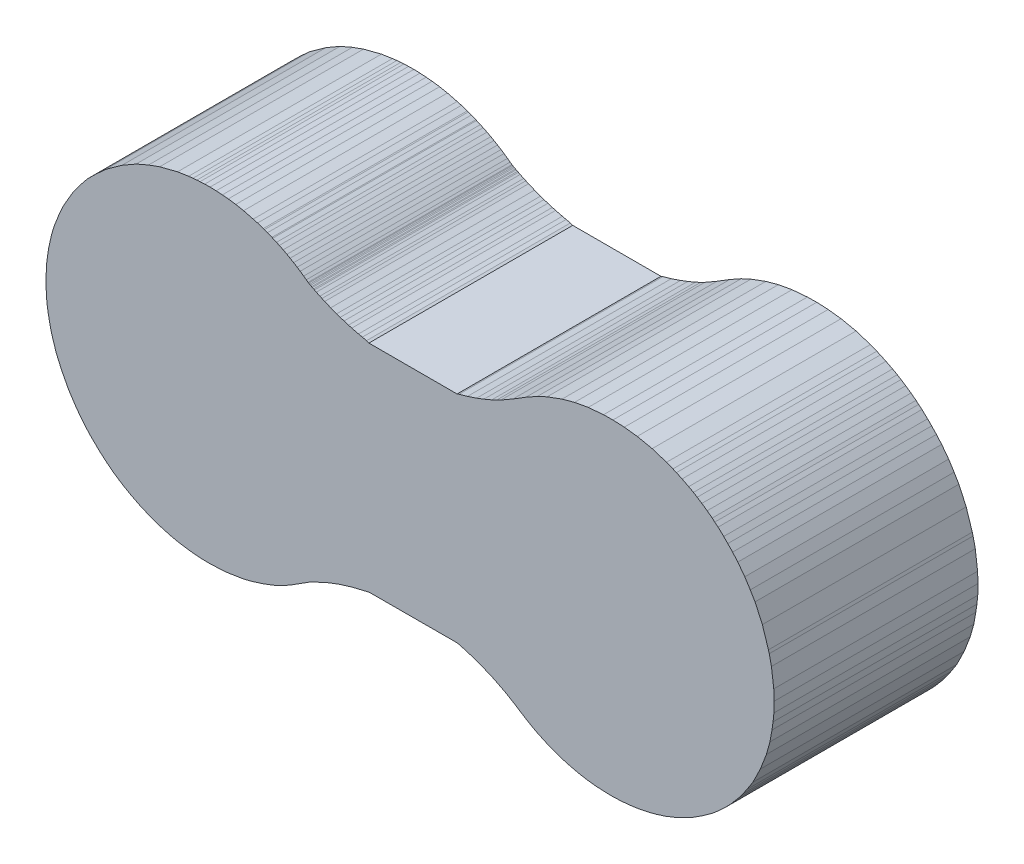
SolidWorks part; units mm, degrees
ref_plane "Front Plane" through (0, 0, 0) normal (0, 0, 1) x (1, 0, 0)
ref_plane "Top Plane" through (0, 0, 0) normal (0, 1, 0) x (1, 0, 0)
ref_plane "Right Plane" through (0, 0, 0) normal (1, 0, 0) x (0, 0, -1)
sketch "GENERAL" plane through (0, 0, 0) normal (0, 0, 1) x (1, 0, 0)
  line L0 (0.1181, 0.2672) -> (-0.1017, 0.2672)
  line L1 (-0.1017, 0.2672) -> (-0.1075, 0.2695)
  line L2 (-0.1075, 0.2695) -> (-0.1181, 0.2718)
  line L3 (-0.1181, 0.2718) -> (-0.1276, 0.2739)
  line L4 (-0.1276, 0.2739) -> (-0.1443, 0.2781)
  line L5 (-0.1443, 0.2781) -> (-0.1526, 0.2804)
  line L6 (-0.1526, 0.2804) -> (-0.1636, 0.2839)
  line L7 (-0.1636, 0.2839) -> (-0.1733, 0.2869)
  line L8 (-0.1733, 0.2869) -> (-0.1821, 0.2901)
  line L9 (-0.1821, 0.2901) -> (-0.1968, 0.2957)
  line L10 (-0.1968, 0.2957) -> (-0.212, 0.3018)
  line L11 (-0.212, 0.3018) -> (-0.2186, 0.3049)
  line L12 (-0.2186, 0.3049) -> (-0.2239, 0.3073)
  line L13 (-0.2239, 0.3073) -> (-0.2327, 0.3115)
  line L14 (-0.2327, 0.3115) -> (-0.2357, 0.3131)
  line L15 (-0.2357, 0.3131) -> (-0.2374, 0.3139)
  line L16 (-0.2374, 0.3139) -> (-0.2395, 0.315)
  line L17 (-0.2395, 0.315) -> (-0.2426, 0.3166)
  line L18 (-0.2426, 0.3166) -> (-0.2444, 0.3176)
  line L19 (-0.2444, 0.3176) -> (-0.2473, 0.3191)
  line L20 (-0.2473, 0.3191) -> (-0.2495, 0.3203)
  line L21 (-0.2495, 0.3203) -> (-0.2516, 0.3215)
  line L22 (-0.2516, 0.3215) -> (-0.2528, 0.3221)
  line L23 (-0.2528, 0.3221) -> (-0.2533, 0.3224)
  line L24 (-0.2533, 0.3224) -> (-0.2577, 0.3258)
  line L25 (-0.2577, 0.3258) -> (-0.2643, 0.3305)
  line L26 (-0.2643, 0.3305) -> (-0.273, 0.3365)
  line L27 (-0.273, 0.3365) -> (-0.2804, 0.3415)
  line L28 (-0.2804, 0.3415) -> (-0.2892, 0.3469)
  line L29 (-0.2892, 0.3469) -> (-0.2981, 0.3522)
  line L30 (-0.2981, 0.3522) -> (-0.306, 0.3566)
  line L31 (-0.306, 0.3566) -> (-0.3155, 0.3616)
  line L32 (-0.3155, 0.3616) -> (-0.3251, 0.3663)
  line L33 (-0.3251, 0.3663) -> (-0.332, 0.3694)
  line L34 (-0.332, 0.3694) -> (-0.3414, 0.3736)
  line L35 (-0.3414, 0.3736) -> (-0.3434, 0.3744)
  line L36 (-0.3434, 0.3744) -> (-0.3546, 0.3789)
  line L37 (-0.3546, 0.3789) -> (-0.3622, 0.3817)
  line L38 (-0.3622, 0.3817) -> (-0.3649, 0.3827)
  line L39 (-0.3649, 0.3827) -> (-0.3792, 0.3875)
  line L40 (-0.3792, 0.3875) -> (-0.3899, 0.3906)
  line L41 (-0.3899, 0.3906) -> (-0.4141, 0.3967)
  line L42 (-0.4141, 0.3967) -> (-0.4335, 0.4005)
  line L43 (-0.4335, 0.4005) -> (-0.4522, 0.403)
  line L44 (-0.4522, 0.403) -> (-0.4669, 0.4044)
  line L45 (-0.4669, 0.4044) -> (-0.4823, 0.4055)
  line L46 (-0.4823, 0.4055) -> (-0.4976, 0.4059)
  line L47 (-0.4976, 0.4059) -> (-0.5109, 0.4057)
  line L48 (-0.5109, 0.4057) -> (-0.5225, 0.4051)
  line L49 (-0.5225, 0.4051) -> (-0.5303, 0.4047)
  line L50 (-0.5303, 0.4047) -> (-0.54, 0.4038)
  line L51 (-0.54, 0.4038) -> (-0.551, 0.4026)
  line L52 (-0.551, 0.4026) -> (-0.5785, 0.3984)
  line L53 (-0.5785, 0.3984) -> (-0.6231, 0.3869)
  line L54 (-0.6231, 0.3869) -> (-0.6508, 0.377)
  line L55 (-0.6508, 0.377) -> (-0.6819, 0.3635)
  line L56 (-0.6819, 0.3635) -> (-0.7168, 0.3433)
  line L57 (-0.7168, 0.3433) -> (-0.7576, 0.314)
  line L58 (-0.7576, 0.314) -> (-0.7821, 0.2915)
  line L59 (-0.7821, 0.2915) -> (-0.8028, 0.2712)
  line L60 (-0.8028, 0.2712) -> (-0.8242, 0.2447)
  line L61 (-0.8242, 0.2447) -> (-0.8394, 0.2233)
  line L62 (-0.8394, 0.2233) -> (-0.8614, 0.1859)
  line L63 (-0.8614, 0.1859) -> (-0.8724, 0.1623)
  line L64 (-0.8724, 0.1623) -> (-0.8811, 0.1402)
  line L65 (-0.8811, 0.1402) -> (-0.8849, 0.1303)
  line L66 (-0.8849, 0.1303) -> (-0.8921, 0.1077)
  line L67 (-0.8921, 0.1077) -> (-0.9001, 0.0717)
  line L68 (-0.9001, 0.0717) -> (-0.9045, 0.0409)
  line L69 (-0.9045, 0.0409) -> (-0.9064, 0.0062)
  line L70 (-0.9064, 0.0062) -> (-0.9064, -0.0114)
  line L71 (-0.9064, -0.0114) -> (-0.9042, -0.0468)
  line L72 (-0.9042, -0.0468) -> (-0.9009, -0.0683)
  line L73 (-0.9009, -0.0683) -> (-0.8943, -0.1005)
  line L74 (-0.8943, -0.1005) -> (-0.8877, -0.1227)
  line L75 (-0.8877, -0.1227) -> (-0.8805, -0.1445)
  line L76 (-0.8805, -0.1445) -> (-0.8682, -0.1728)
  line L77 (-0.8682, -0.1728) -> (-0.8506, -0.2066)
  line L78 (-0.8506, -0.2066) -> (-0.831, -0.2363)
  line L79 (-0.831, -0.2363) -> (-0.8178, -0.2545)
  line L80 (-0.8178, -0.2545) -> (-0.8044, -0.2702)
  line L81 (-0.8044, -0.2702) -> (-0.7942, -0.281)
  line L82 (-0.7942, -0.281) -> (-0.7737, -0.3011)
  line L83 (-0.7737, -0.3011) -> (-0.7545, -0.3177)
  line L84 (-0.7545, -0.3177) -> (-0.7374, -0.3308)
  line L85 (-0.7374, -0.3308) -> (-0.7239, -0.34)
  line L86 (-0.7239, -0.34) -> (-0.7137, -0.3464)
  line L87 (-0.7137, -0.3464) -> (-0.6962, -0.3566)
  line L88 (-0.6962, -0.3566) -> (-0.6705, -0.3697)
  line L89 (-0.6705, -0.3697) -> (-0.65, -0.3781)
  line L90 (-0.65, -0.3781) -> (-0.6283, -0.3864)
  line L91 (-0.6283, -0.3864) -> (-0.5995, -0.3947)
  line L92 (-0.5995, -0.3947) -> (-0.5757, -0.4001)
  line L93 (-0.5757, -0.4001) -> (-0.5478, -0.4042)
  line L94 (-0.5478, -0.4042) -> (-0.5235, -0.4065)
  line L95 (-0.5235, -0.4065) -> (-0.502, -0.4071)
  line L96 (-0.502, -0.4071) -> (-0.4639, -0.4057)
  line L97 (-0.4639, -0.4057) -> (-0.4478, -0.4036)
  line L98 (-0.4478, -0.4036) -> (-0.4134, -0.398)
  line L99 (-0.4134, -0.398) -> (-0.3919, -0.3926)
  line L100 (-0.3919, -0.3926) -> (-0.3635, -0.3835)
  line L101 (-0.3635, -0.3835) -> (-0.341, -0.375)
  line L102 (-0.341, -0.375) -> (-0.3232, -0.367)
  line L103 (-0.3232, -0.367) -> (-0.2985, -0.3537)
  line L104 (-0.2985, -0.3537) -> (-0.2604, -0.3295)
  line L105 (-0.2604, -0.3295) -> (-0.2491, -0.3224)
  line L106 (-0.2491, -0.3224) -> (-0.2342, -0.3151)
  line L107 (-0.2342, -0.3151) -> (-0.2079, -0.3028)
  line L108 (-0.2079, -0.3028) -> (-0.1868, -0.2945)
  line L109 (-0.1868, -0.2945) -> (-0.1741, -0.2899)
  line L110 (-0.1741, -0.2899) -> (-0.1451, -0.281)
  line L111 (-0.1451, -0.281) -> (-0.1265, -0.2764)
  line L112 (-0.1265, -0.2764) -> (-0.1102, -0.2726)
  line L113 (-0.1102, -0.2726) -> (-0.1013, -0.2702)
  line L114 (-0.1013, -0.2702) -> (-0.0886, -0.2702)
  line L115 (-0.0886, -0.2702) -> (0.1186, -0.2699)
  line L116 (0.1186, -0.2699) -> (0.1268, -0.2719)
  line L117 (0.1268, -0.2719) -> (0.1438, -0.2769)
  line L118 (0.1438, -0.2769) -> (0.1632, -0.2833)
  line L119 (0.1632, -0.2833) -> (0.18, -0.2895)
  line L120 (0.18, -0.2895) -> (0.2059, -0.3002)
  line L121 (0.2059, -0.3002) -> (0.2223, -0.3083)
  line L122 (0.2223, -0.3083) -> (0.2382, -0.3165)
  line L123 (0.2382, -0.3165) -> (0.2608, -0.3299)
  line L124 (0.2608, -0.3299) -> (0.2739, -0.3382)
  line L125 (0.2739, -0.3382) -> (0.2765, -0.3401)
  line L126 (0.2765, -0.3401) -> (0.2933, -0.3504)
  line L127 (0.2933, -0.3504) -> (0.3076, -0.3587)
  line L128 (0.3076, -0.3587) -> (0.3201, -0.3653)
  line L129 (0.3201, -0.3653) -> (0.3414, -0.375)
  line L130 (0.3414, -0.375) -> (0.3593, -0.3823)
  line L131 (0.3593, -0.3823) -> (0.3827, -0.3901)
  line L132 (0.3827, -0.3901) -> (0.3997, -0.3949)
  line L133 (0.3997, -0.3949) -> (0.4221, -0.4001)
  line L134 (0.4221, -0.4001) -> (0.4429, -0.4037)
  line L135 (0.4429, -0.4037) -> (0.4627, -0.4059)
  line L136 (0.4627, -0.4059) -> (0.4817, -0.4072)
  line L137 (0.4817, -0.4072) -> (0.5052, -0.4078)
  line L138 (0.5052, -0.4078) -> (0.5276, -0.4069)
  line L139 (0.5276, -0.4069) -> (0.5542, -0.4043)
  line L140 (0.5542, -0.4043) -> (0.5738, -0.4013)
  line L141 (0.5738, -0.4013) -> (0.5937, -0.3971)
  line L142 (0.5937, -0.3971) -> (0.6127, -0.3922)
  line L143 (0.6127, -0.3922) -> (0.6358, -0.3851)
  line L144 (0.6358, -0.3851) -> (0.6623, -0.3746)
  line L145 (0.6623, -0.3746) -> (0.682, -0.3652)
  line L146 (0.682, -0.3652) -> (0.7064, -0.3523)
  line L147 (0.7064, -0.3523) -> (0.7319, -0.3358)
  line L148 (0.7319, -0.3358) -> (0.7543, -0.3196)
  line L149 (0.7543, -0.3196) -> (0.7677, -0.3082)
  line L150 (0.7677, -0.3082) -> (0.7855, -0.2918)
  line L151 (0.7855, -0.2918) -> (0.7992, -0.2778)
  line L152 (0.7992, -0.2778) -> (0.8201, -0.2533)
  line L153 (0.8201, -0.2533) -> (0.8304, -0.2395)
  line L154 (0.8304, -0.2395) -> (0.8404, -0.2251)
  line L155 (0.8404, -0.2251) -> (0.8553, -0.202)
  line L156 (0.8553, -0.202) -> (0.8738, -0.1644)
  line L157 (0.8738, -0.1644) -> (0.8889, -0.1253)
  line L158 (0.8889, -0.1253) -> (0.8978, -0.0938)
  line L159 (0.8978, -0.0938) -> (0.9028, -0.0657)
  line L160 (0.9028, -0.0657) -> (0.9055, -0.0468)
  line L161 (0.9055, -0.0468) -> (0.9076, -0.0264)
  line L162 (0.9076, -0.0264) -> (0.9083, -0.0008)
  line L163 (0.9083, -0.0008) -> (0.9072, 0.0253)
  line L164 (0.9072, 0.0253) -> (0.9015, 0.0709)
  line L165 (0.9015, 0.0709) -> (0.8961, 0.0957)
  line L166 (0.8961, 0.0957) -> (0.894, 0.103)
  line L167 (0.894, 0.103) -> (0.8789, 0.1499)
  line L168 (0.8789, 0.1499) -> (0.8607, 0.1898)
  line L169 (0.8607, 0.1898) -> (0.8487, 0.2098)
  line L170 (0.8487, 0.2098) -> (0.8351, 0.2312)
  line L171 (0.8351, 0.2312) -> (0.8177, 0.2542)
  line L172 (0.8177, 0.2542) -> (0.8046, 0.2692)
  line L173 (0.8046, 0.2692) -> (0.7927, 0.2816)
  line L174 (0.7927, 0.2816) -> (0.7826, 0.2919)
  line L175 (0.7826, 0.2919) -> (0.7685, 0.3051)
  line L176 (0.7685, 0.3051) -> (0.7603, 0.3118)
  line L177 (0.7603, 0.3118) -> (0.7538, 0.3173)
  line L178 (0.7538, 0.3173) -> (0.7412, 0.3268)
  line L179 (0.7412, 0.3268) -> (0.7281, 0.336)
  line L180 (0.7281, 0.336) -> (0.7165, 0.3435)
  line L181 (0.7165, 0.3435) -> (0.707, 0.3492)
  line L182 (0.707, 0.3492) -> (0.6953, 0.3559)
  line L183 (0.6953, 0.3559) -> (0.6788, 0.3642)
  line L184 (0.6788, 0.3642) -> (0.6648, 0.3708)
  line L185 (0.6648, 0.3708) -> (0.656, 0.3744)
  line L186 (0.656, 0.3744) -> (0.64, 0.3808)
  line L187 (0.64, 0.3808) -> (0.6043, 0.3924)
  line L188 (0.6043, 0.3924) -> (0.567, 0.4001)
  line L189 (0.567, 0.4001) -> (0.5348, 0.4039)
  line L190 (0.5348, 0.4039) -> (0.5064, 0.4053)
  line L191 (0.5064, 0.4053) -> (0.4831, 0.4049)
  line L192 (0.4831, 0.4049) -> (0.4449, 0.4016)
  line L193 (0.4449, 0.4016) -> (0.4109, 0.3955)
  line L194 (0.4109, 0.3955) -> (0.3797, 0.387)
  line L195 (0.3797, 0.387) -> (0.3424, 0.3732)
  line L196 (0.3424, 0.3732) -> (0.3182, 0.362)
  line L197 (0.3182, 0.362) -> (0.2898, 0.3461)
  line L198 (0.2898, 0.3461) -> (0.2576, 0.3262)
  line L199 (0.2576, 0.3262) -> (0.2273, 0.3088)
  line L200 (0.2273, 0.3088) -> (0.217, 0.3036)
  line L201 (0.217, 0.3036) -> (0.2044, 0.2977)
  line L202 (0.2044, 0.2977) -> (0.185, 0.2895)
  line L203 (0.185, 0.2895) -> (0.1669, 0.2827)
  line L204 (0.1669, 0.2827) -> (0.1438, 0.2748)
  line L205 (0.1438, 0.2748) -> (0.123, 0.2689)
  line L206 (0.123, 0.2689) -> (0.1189, 0.2676)
  line L207 (0.1189, 0.2676) -> (0.1181, 0.2672)
extrude "Boss-Extrude1" add sketch "GENERAL" along normal blind 0.508
